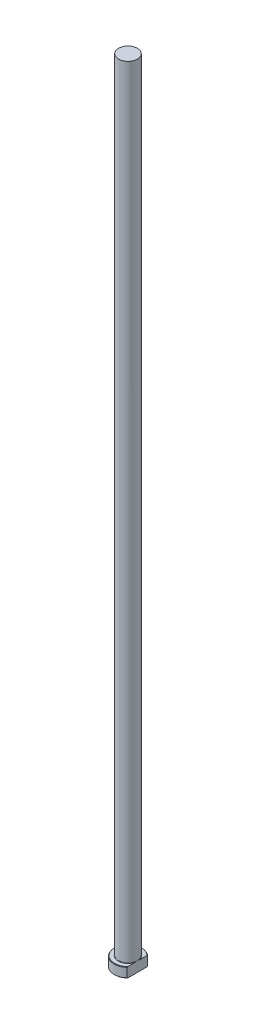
SolidWorks part; units mm, degrees
ref_plane "Front Plane" through (0, 0, 0) normal (0, 0, 1) x (1, 0, 0)
ref_plane "Top Plane" through (0, 0, 0) normal (0, 1, 0) x (1, 0, 0)
ref_plane "Right Plane" through (0, 0, 0) normal (1, 0, 0) x (0, 0, -1)
sketch "Sketch1" plane through (0, 0, 0) normal (0, 0, 1) x (1, 0, 0)
  line L0 (0, 259.9588) -> (0, -15.1925) construction
  line L1 (0, 0) -> (-7, 0)
  line L2 (-7, 0) -> (-7, 5)
  line L3 (-7, 5) -> (-4.75, 5)
  line L4 (-4.75, 5) -> (-4.75, 400)
  line L5 (-4.75, 400) -> (0, 400)
  line L6 (0, 400) -> (0, 0)
  dimension "L" = 400
  dimension "H" = 14
  dimension "T" = 5
  dimension "D" = 9.5
revolve "Revolve1" add sketch "Sketch1" angle 360 about L0
chamfer "Chamfer1" distance 0.2 angle 45 2 edges at (0, 5, 7) (0, 0, 7)
fillet "Fillet1" radius 0.2 1 edges at (0, 5, 4.75)
sketch "Sketch2" plane through (0, 0, 0) normal (0, 1, 0) x (1, 0, 0)
  line L0 (4.75, 5.1417) -> (4.75, -5.1417)
  circle A0 centre (0, 0) radius 7 construction
  arc A1 (4.75, -5.1417) -> (4.75, 5.1417) centre (0, 0) ccw
  circle A2 centre (0, 0) radius 4.75 construction
extrude "KEY" cut sketch "Sketch2" along normal through all
